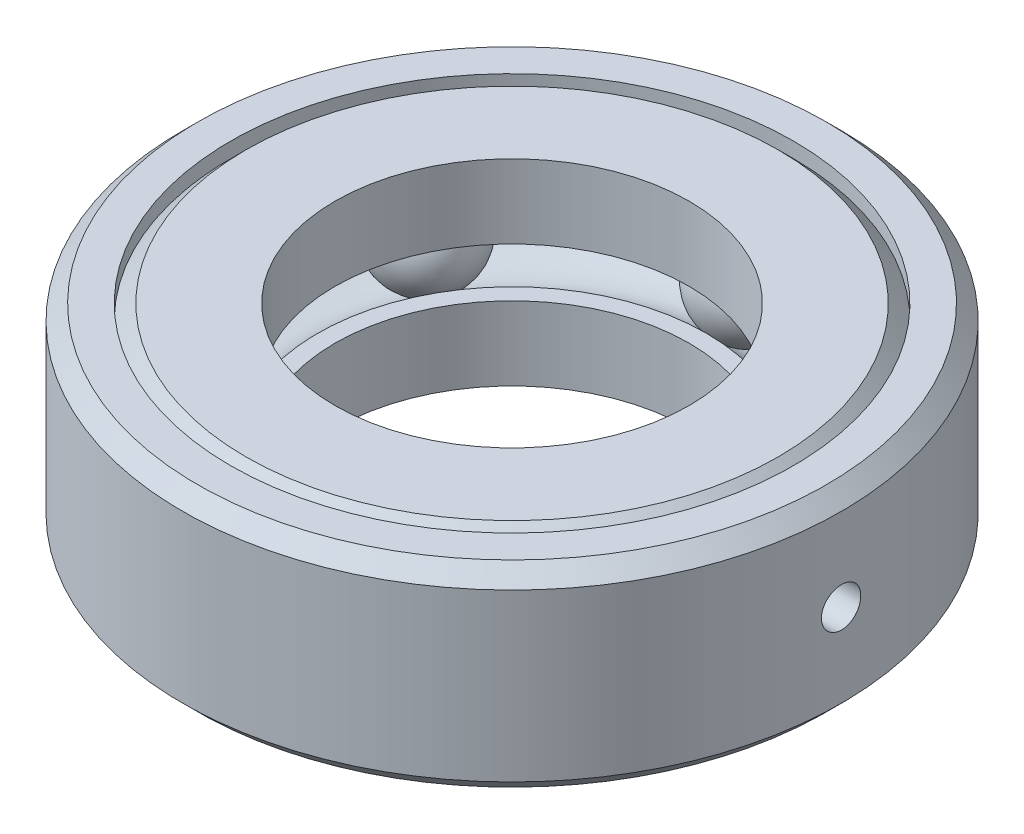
SolidWorks part; units mm, degrees
ref_plane "Front Plane" through (0, 0, 0) normal (0, 0, 1) x (1, 0, 0)
ref_plane "Top Plane" through (0, 0, 0) normal (0, 1, 0) x (1, 0, 0)
ref_plane "Right Plane" through (0, 0, 0) normal (1, 0, 0) x (0, 0, -1)
sketch "Sketch1" plane through (0, 0, 0) normal (1, 0, 0) x (0, 0, -1)
  line L0 (-19.1095, 0) -> (19.1095, 0) construction
  line L1 (0, -7.9375) -> (0, 7.9375) construction
  line L2 (-21.4657, 7.9375) -> (-14.2875, 7.9375)
  line L3 (-22.5466, 1.9844) -> (-23.9316, 1.9844)
  line L4 (-23.9316, 1.9844) -> (-23.9316, 5.4716)
  line L5 (-23.9316, 5.4716) -> (-21.4657, 7.9375)
  line L6 (-14.2875, 7.9375) -> (-14.2875, 1.9844)
  line L7 (-14.2875, 1.9844) -> (-15.6725, 1.9844)
  line L8 (-19.1095, 3.9688) -> (-19.1095, 0) construction
  line L9 (-23.0783, 0) -> (-26.5906, 0) construction
  line L10 (-14.2875, -7.9375) -> (-14.2875, -1.9844)
  line L11 (-14.2875, -1.9844) -> (-15.6725, -1.9844)
  line L12 (-22.5466, -1.9844) -> (-23.9316, -1.9844)
  line L13 (-23.9316, -1.9844) -> (-23.9316, -5.4716)
  line L14 (-23.9316, -5.4716) -> (-21.4657, -7.9375)
  line L15 (-21.4657, -7.9375) -> (-14.2875, -7.9375)
  circle A0 centre (-19.1095, 0) radius 3.9688 construction
  arc A1 (-15.6725, 1.9844) -> (-22.5466, 1.9844) centre (-19.1095, 0) ccw
  arc A2 (-15.6725, -1.9844) -> (-22.5466, -1.9844) centre (-19.1095, 0) cw
  point P15 (-19.1095, 1.9844)
  dimension "D2" = 7.9375
  dimension "D1" = 45
  dimension "OD" = 53.1812
  dimension "Shaft Dia" = 28.575
  dimension "Th" = 15.875
  dimension "D3" = 47.8631
revolve "Revolve1" add sketch "Sketch1" angle 360 about L1
sketch "Sketch3" plane through (0, 0, 0) normal (1, 0, 0) x (0, 0, -1)
  line L0 (-19.1095, 3.9688) -> (-19.1095, -3.9687)
  arc A0 (-22.5466, -1.9844) -> (-15.6725, -1.9844) centre (-19.1095, 0) ccw construction
  arc A1 (-19.1095, 3.9688) -> (-19.1095, -3.9687) centre (-19.1095, 0) ccw
revolve "Revolve2" add sketch "Sketch3" angle 360 about L0
ref_axis "Axis1" through (0, 7.9375, 0) along (0, -1, 0)
pattern_circular "CirPattern1" count 6 every 60 about axis through (0, 7.9375, 0) along (0, -1, 0)
sketch "Sketch4" plane through (0, 0, 0) normal (1, 0, 0) x (0, 0, -1)
  line L0 (-22.6986, 7.9375) -> (-25.3577, 7.9375)
  line L1 (-25.3577, 7.9375) -> (-26.5906, 6.7046)
  line L2 (-22.6986, -7.9375) -> (-22.6986, -6.7046)
  line L3 (-23.9316, -5.4716) -> (-21.4657, -7.9375) construction
  line L4 (-22.6986, -6.7046) -> (-23.9316, -5.4716)
  line L5 (-23.9316, -5.4716) -> (-23.9316, 5.4716)
  line L6 (-23.9316, 5.4716) -> (-22.6986, 6.7046)
  line L7 (-23.9316, 5.4716) -> (-21.4657, 7.9375) construction
  line L8 (-22.6986, 6.7046) -> (-22.6986, 7.9375)
  line L9 (-26.5906, 6.7046) -> (-26.5906, -6.7046)
  line L10 (-26.5906, -6.7046) -> (-25.3577, -7.9375)
  line L11 (-25.3577, -7.9375) -> (-22.6986, -7.9375)
  line L12 (-21.4657, 7.9375) -> (-14.2875, 7.9375) construction
  line L13 (-21.4657, -7.9375) -> (-14.2875, -7.9375) construction
revolve "Revolve3" add sketch "Sketch4" angle 360 about L1
sketch "Sketch5" plane through (0, 0, 0) normal (1, 0, 0) x (0, 0, -1)
  circle A0 centre (0, 0) radius 1.5875
  dimension "D1" = 3.175
extrude "Cut-Extrude1" cut sketch "Sketch5" along normal through all
equation "\"D2@Sketch1\" = \"Th@Sketch1\"/2"
equation "\"Balls@CirPattern1\" = \"OD@Sketch1\"*3"
equation "\"Angle@CirPattern1\" = 360/\"Balls@CirPattern1\""
equation "\"D3@Sketch1\" = \"OD@Sketch1\"*.9"
